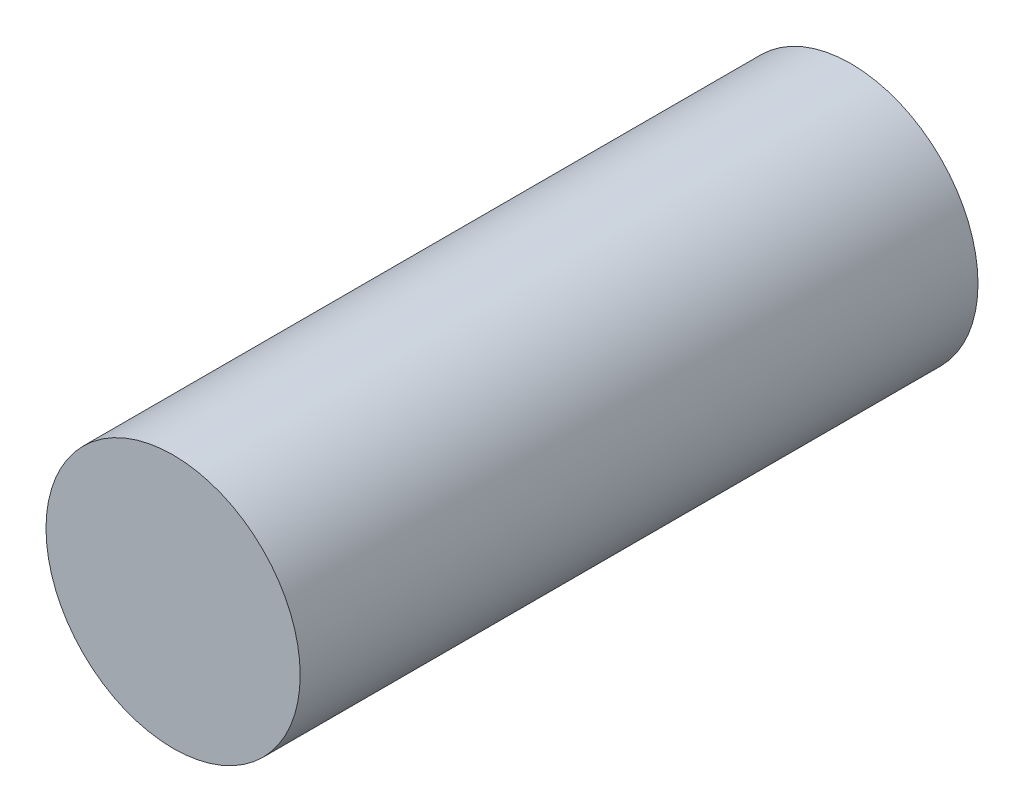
SolidWorks part; units mm, degrees
ref_plane "Plan de face" through (0, 0, 0) normal (0, 0, 1) x (1, 0, 0)
ref_plane "Plan de dessus" through (0, 0, 0) normal (0, 1, 0) x (1, 0, 0)
ref_plane "Plan de droite" through (0, 0, 0) normal (1, 0, 0) x (0, 0, -1)
sketch "Esquisse1" plane through (0, 0, 0) normal (0, 0, 1) x (1, 0, 0)
  circle A0 centre (0, 0) radius 1.5
  dimension "D1" = 3
extrude "Boss.-Extru.1" add sketch "Esquisse1" along normal blind 8
